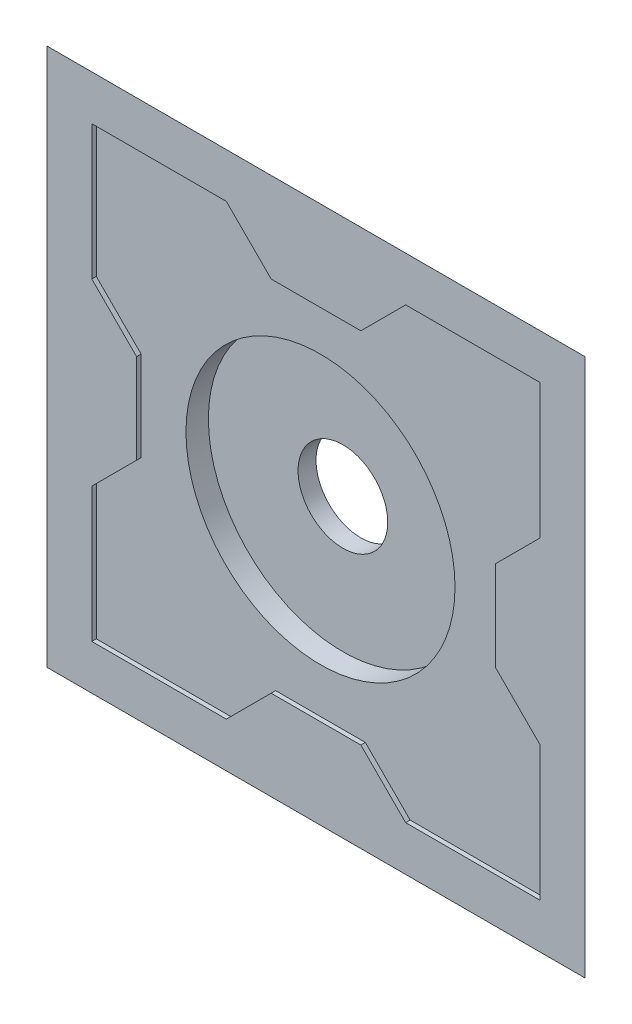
SolidWorks part; units mm, degrees
ref_plane "Front Plane" through (0, 0, 0) normal (0, 0, 1) x (1, 0, 0)
ref_plane "Top Plane" through (0, 0, 0) normal (0, 1, 0) x (1, 0, 0)
ref_plane "Right Plane" through (0, 0, 0) normal (1, 0, 0) x (0, 0, -1)
sketch "Sketch1" plane through (0, 0, 0) normal (0, 0, 1) x (1, 0, 0)
  line L1 (-60, -60) -> (60, -60)
  line L2 (-60, -60) -> (-60, 60)
  line L3 (-60, 60) -> (60, 60)
  line L4 (60, -60) -> (60, 60)
  line L5 (-60, -60) -> (60, 60) construction
  line L6 (-60, 60) -> (60, -60) construction
  point P0 (0, 0)
  dimension "D1" = 120
  dimension "D2" = 120
extrude "Boss-Extrude1" add sketch "Sketch1" along normal blind 10
sketch "Sketch2" plane through (0, 0, 10) normal (0, 0, 1) x (1, 0, 0)
  line L0 (-50, 50) -> (-20, 50)
  line L1 (-20, 50) -> (-10, 40)
  line L2 (-10, 40) -> (10, 40)
  line L3 (10, 40) -> (20, 50)
  line L4 (20, 50) -> (50, 50)
  line L5 (-50, 50) -> (-50, 20)
  line L6 (-50, 20) -> (-40, 10)
  line L7 (-40, 10) -> (-40, -10)
  line L8 (-40, -10) -> (-50, -20)
  line L9 (-50, -20) -> (-50, -50)
  line L10 (-60, 60) -> (-60, -60) construction
  line L11 (60, 60) -> (-60, 60) construction
  line L12 (-50, -50) -> (-20, -50)
  line L13 (-20, -50) -> (-10, -40)
  line L14 (-10, -40) -> (10, -40)
  line L15 (10, -40) -> (20, -50)
  line L16 (20, -50) -> (50, -50)
  line L17 (50, -50) -> (50, -20)
  line L18 (50, -20) -> (40, -10)
  line L19 (40, -10) -> (40, 10)
  line L20 (40, 10) -> (50, 20)
  line L21 (50, 20) -> (50, 50)
  line L23 (-60, -60) -> (60, -60) construction
  line L25 (15, 36.2132) -> (-15, 36.2132)
  line L26 (-15, 36.2132) -> (-36.2132, 15)
  line L27 (-36.2132, 15) -> (-36.2132, -15)
  line L28 (-36.2132, -15) -> (-15, -36.2132)
  line L29 (-15, -36.2132) -> (15, -36.2132)
  line L30 (15, -36.2132) -> (36.2132, -15)
  line L31 (36.2132, -15) -> (36.2132, 15)
  line L32 (36.2132, 15) -> (15, 36.2132)
  circle A0 centre (0, 0) radius 36.2132 construction
  dimension "D1" = 30
  dimension "D2" = 20
  dimension "D3" = 30
  dimension "D4" = 10
  dimension "D5" = 10
  dimension "D6" = 10
  dimension "D7" = 10
  dimension "D8" = 10
  dimension "D9" = 20
  dimension "D10" = 10
  dimension "D11" = 10
  dimension "D12" = 30
extrude "Cut-Extrude1" cut sketch "Sketch2" against normal blind 1
sketch "Sketch9" plane through (0, 0, 0) normal (0, 0, -1) x (-1, 0, 0)
  line L0 (-60, 60) -> (60, 60) construction
  line L1 (-40, 57.5) -> (-20, 57.5)
  line L2 (-40, 57.5) -> (-40, 52.5)
  line L3 (-40, 52.5) -> (-20, 52.5)
  line L4 (-20, 57.5) -> (-20, 52.5)
  line L5 (20, 57.5) -> (40, 57.5)
  line L6 (20, 57.5) -> (20, 52.5)
  line L7 (20, 52.5) -> (40, 52.5)
  line L8 (40, 57.5) -> (40, 52.5)
  line L9 (52.5, 40) -> (57.5, 40)
  line L10 (52.5, 40) -> (52.5, 20)
  line L11 (52.5, 20) -> (57.5, 20)
  line L12 (57.5, 40) -> (57.5, 20)
  line L13 (57.5, -20) -> (52.5, -20)
  line L14 (57.5, -20) -> (57.5, -40)
  line L15 (57.5, -40) -> (52.5, -40)
  line L16 (52.5, -20) -> (52.5, -40)
  line L17 (40, -52.5) -> (20, -52.5)
  line L18 (40, -52.5) -> (40, -57.5)
  line L19 (40, -57.5) -> (20, -57.5)
  line L20 (20, -52.5) -> (20, -57.5)
  line L21 (-20, -57.5) -> (-40, -57.5)
  line L22 (-20, -57.5) -> (-20, -52.5)
  line L23 (-20, -52.5) -> (-40, -52.5)
  line L24 (-40, -57.5) -> (-40, -52.5)
  line L25 (-57.5, -40) -> (-52.5, -40)
  line L26 (-57.5, -40) -> (-57.5, -20)
  line L27 (-57.5, -20) -> (-52.5, -20)
  line L28 (-52.5, -40) -> (-52.5, -20)
  line L29 (-52.5, 20) -> (-57.5, 20)
  line L30 (-52.5, 20) -> (-52.5, 40)
  line L31 (-52.5, 40) -> (-57.5, 40)
  line L32 (-57.5, 20) -> (-57.5, 40)
  line L33 (-60, -60) -> (-60, 60) construction
  line L35 (60, -60) -> (-60, -60) construction
  line L36 (60, 60) -> (60, -60) construction
  dimension "D1" = 20
  dimension "D2" = 5
  dimension "D3" = 2.5
  dimension "D4" = 20
  dimension "D5" = 40
  dimension "D6" = 2.5
  dimension "D7" = 2.5
  dimension "D8" = 2.5
  dimension "D9" = 40
  dimension "D10" = 20
  dimension "D11" = 2.5
  dimension "D12" = 2.5
  dimension "D13" = 40
sketch "Sketch10" plane through (0, 0, 10) normal (0, 0, 1) x (1, 0, 0)
  line L1 (15, 36.2132) -> (-15, 36.2132)
  line L2 (-15, 36.2132) -> (-36.2132, 15)
  line L3 (-36.2132, 15) -> (-36.2132, -15)
  line L4 (-36.2132, -15) -> (-15, -36.2132)
  line L5 (-15, -36.2132) -> (15, -36.2132)
  line L6 (15, -36.2132) -> (36.2132, -15)
  line L7 (36.2132, -15) -> (36.2132, 15)
  line L8 (36.2132, 15) -> (15, 36.2132)
  circle A0 centre (0, 0) radius 36.2132 construction
extrude "Cut-Extrude6" cut sketch "Sketch10" against normal blind 1
sketch "Sketch11" plane through (0, 0, 9) normal (0, 0, 1) x (1, 0, 0)
  circle A0 centre (0, 0) radius 30
  dimension "D1" = 60
extrude "Cut-Extrude7" cut sketch "Sketch11" against normal blind 5
sketch "Sketch12" plane through (0, 0, 4) normal (0, 0, 1) x (1, 0, 0)
  circle A0 centre (0, 0) radius 10
  dimension "D1" = 20
extrude "Cut-Extrude8" cut sketch "Sketch12" against normal through all
chamfer "Chamfer1" distance 10 angle 45 4 edges at (60, 0, 0) (0, -60, 0) (-60, 0, 0) (0, 60, 0)
